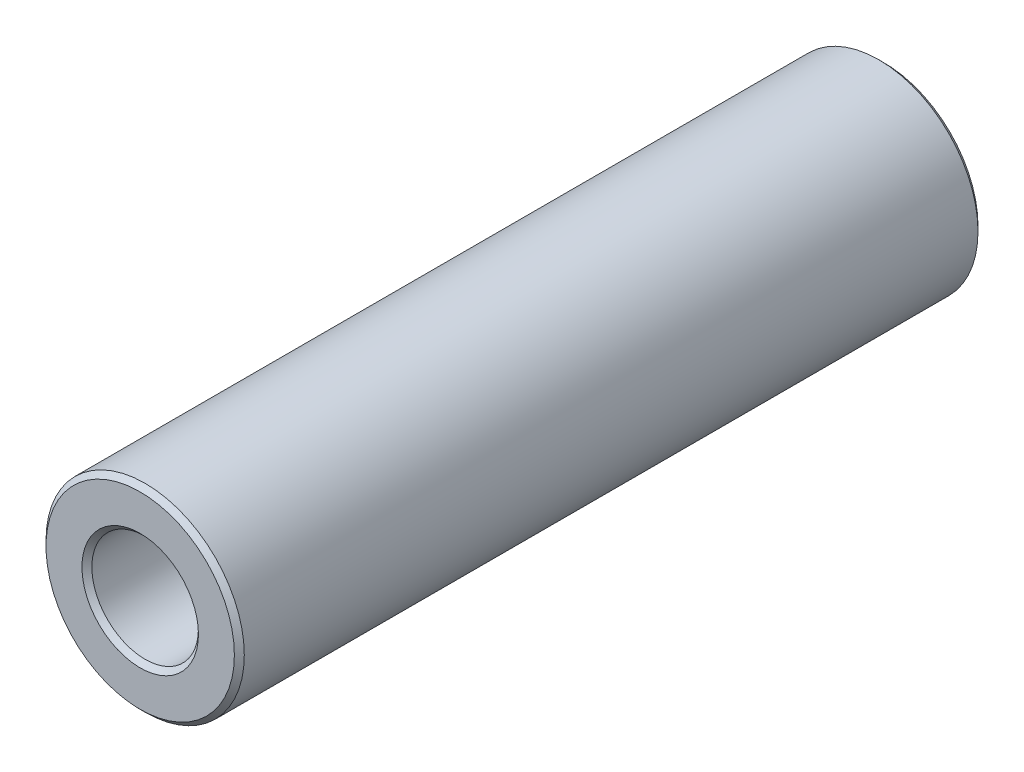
SolidWorks part; units mm, degrees
ref_plane "Front Plane" through (0, 0, 0) normal (0, 0, 1) x (1, 0, 0)
ref_plane "Top Plane" through (0, 0, 0) normal (0, 1, 0) x (1, 0, 0)
ref_plane "Right Plane" through (0, 0, 0) normal (1, 0, 0) x (0, 0, -1)
sketch "Sketch1" plane through (0, 0, 0) normal (0, 0, 1) x (1, 0, 0)
  circle A0 centre (0, 0) radius 4
  circle A1 centre (0, 0) radius 2.15
  dimension "D1" = 8
  dimension "D2" = 4.3
extrude "Boss-Extrude2" add sketch "Sketch1" along normal mid plane 30
chamfer "Chamfer3" distance 0.2 angle 45 4 edges at (4, 0, 15) (4, 0, -15) (2.15, 0, -15) (2.15, 0, 15)
